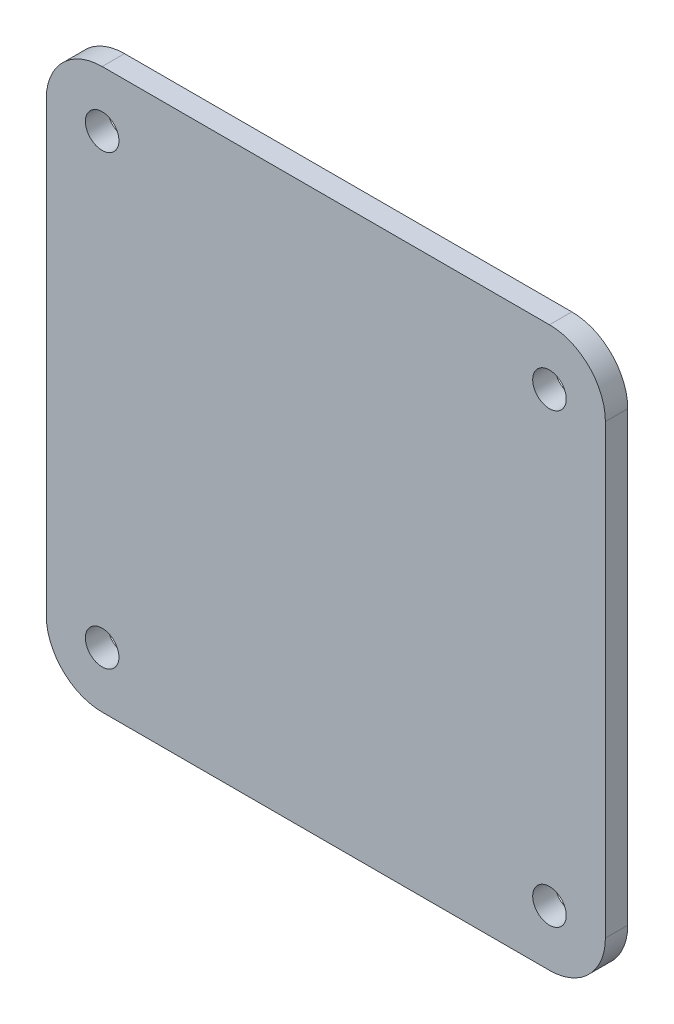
SolidWorks part; units mm, degrees
ref_plane "Plan de face" through (0, 0, 0) normal (0, 0, 1) x (1, 0, 0)
ref_plane "Plan de dessus" through (0, 0, 0) normal (0, 1, 0) x (1, 0, 0)
ref_plane "Plan de droite" through (0, 0, 0) normal (1, 0, 0) x (0, 0, -1)
sketch "Esquisse1" plane through (0, 0, 0) normal (0, 0, 1) x (1, 0, 0)
  line L1 (0, 0) -> (-100, 0)
  line L2 (0, 0) -> (0, 100)
  line L3 (0, 100) -> (-100, 100)
  line L4 (-100, 0) -> (-100, 100)
  dimension "D1" = 100
  dimension "D2" = 100
extrude "Boss.-Extru.1" add sketch "Esquisse1" along normal blind 4
fillet "Congé1" radius 10 4 edges at (-100, 0, 2) (0, 0, 2) (-100, 100, 2) (0, 100, 2)
sketch "Esquisse2" plane through (0, 0, 4) normal (0, 0, 1) x (1, 0, 0)
  line L0 (-90, 0) -> (-10, 0) construction
  line L1 (-10, 100) -> (-90, 100) construction
  line L2 (-100, 90) -> (-100, 10) construction
  circle A0 centre (-10, 10) radius 3
  circle A1 centre (-10, 90) radius 3
  circle A2 centre (-90, 10) radius 3
  circle A3 centre (-90, 90) radius 3
  dimension "D3" = 6
  dimension "D6" = 6
  dimension "D7" = 6
  dimension "D8" = 6
  dimension "D1" = 10
  dimension "D2" = 10
  dimension "D4" = 10
  dimension "D5" = 10
extrude "Enlèv. mat.-Extru.1" cut sketch "Esquisse2" against normal through all
